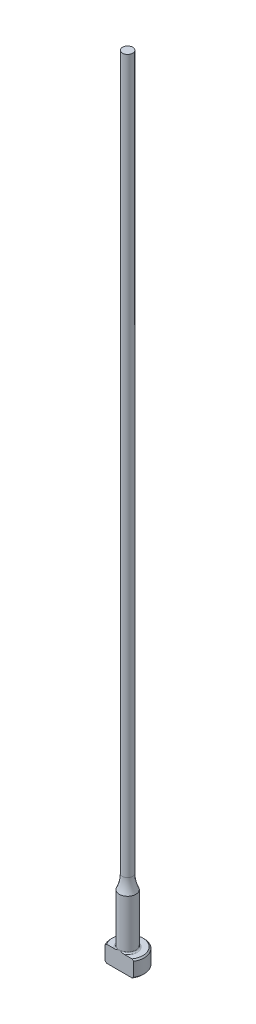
SolidWorks part; units mm, degrees
ref_plane "Front Plane" through (0, 0, 0) normal (0, 0, 1) x (1, 0, 0)
ref_plane "Top Plane" through (0, 0, 0) normal (0, 1, 0) x (1, 0, 0)
ref_plane "Right Plane" through (0, 0, 0) normal (1, 0, 0) x (0, 0, -1)
sketch "Sketch1" plane through (0, 0, 0) normal (0, 0, 1) x (1, 0, 0)
  line L0 (0, 259.9588) -> (0, -15.1925) construction
  line L1 (0, 0) -> (-3.175, 0)
  line L2 (-3.175, 0) -> (-3.175, 3.175)
  line L3 (-3.175, 3.175) -> (-1.5875, 3.175)
  line L4 (-0.9919, 15.3851) -> (-0.9919, 152.4)
  line L5 (-0.9919, 152.4) -> (0, 152.4)
  line L6 (0, 152.4) -> (0, 0)
  line L7 (-1.5875, 3.175) -> (-1.5875, 12.7)
  arc A0 (-1.5875, 12.7) -> (-0.9919, 15.3851) centre (-7.3419, 15.3851) ccw
  point P13 (-1.5875, 0)
  dimension "D1" = 6.35
  dimension "L" = 152.4
  dimension "D2" = 3.175
  dimension "H" = 6.35
  dimension "T" = 3.175
  dimension "D" = 1.9837
  dimension "S" = 12.7
revolve "Revolve1" add sketch "Sketch1" angle 360 about L0
chamfer "Chamfer1" distance 0.254 angle 45 2 edges at (0, 3.175, 3.175) (0, 0, 3.175)
fillet "Fillet1" radius 0.254 1 edges at (0, 3.175, 1.5875)
sketch "Sketch2" plane through (0, 0, 0) normal (0, -1, 0) x (1, 0, 0)
  line L0 (-2.7496, 1.5875) -> (2.7496, 1.5875)
  circle A0 centre (0, 0) radius 3.175 construction
  arc A1 (2.7496, 1.5875) -> (-2.7496, 1.5875) centre (0, 0) ccw
  circle A4 centre (0, 0) radius 1.5875 construction
  dimension "D1" = 0
extrude "KEY" cut sketch "Sketch2" against normal through all
